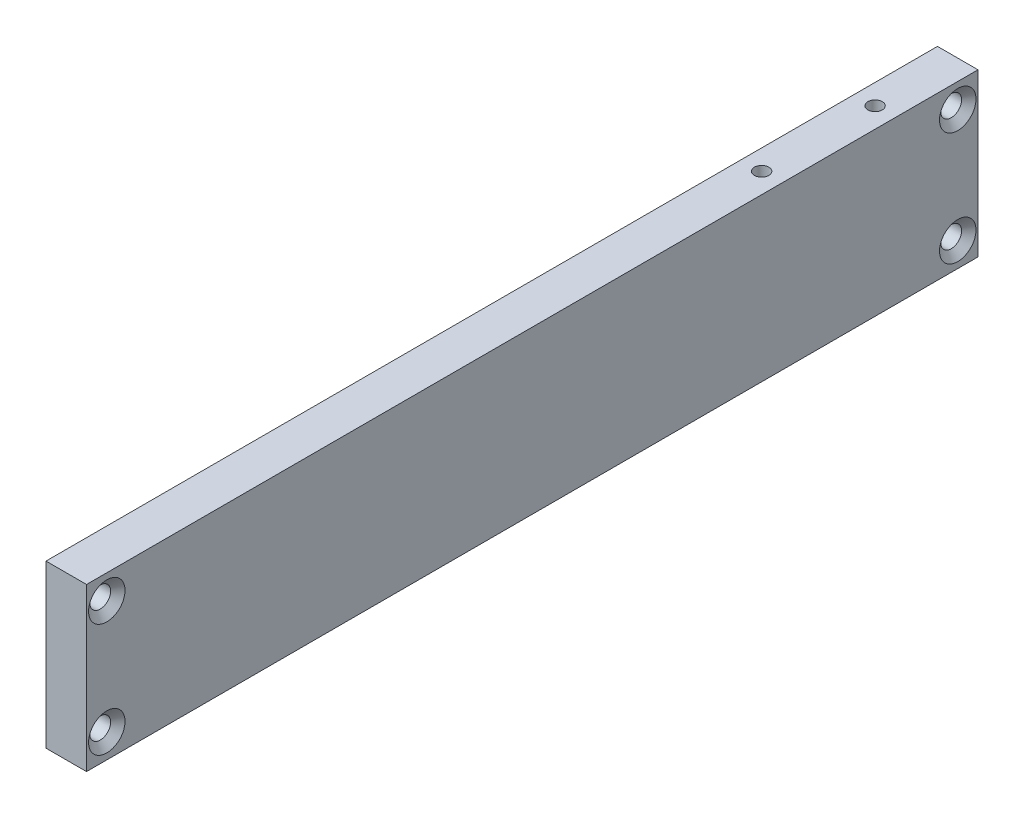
SolidWorks part; units mm, degrees
ref_plane "Front Plane" through (0, 0, 0) normal (0, 0, 1) x (1, 0, 0)
ref_plane "Top Plane" through (0, 0, 0) normal (0, 1, 0) x (1, 0, 0)
ref_plane "Right Plane" through (0, 0, 0) normal (1, 0, 0) x (0, 0, -1)
sketch "Sketch1" plane through (0, 0, 0) normal (1, 0, 0) x (0, 0, -1)
  line L1 (-69.85, 15.24) -> (69.85, 15.24)
  line L2 (-69.85, 15.24) -> (-69.85, -10.16)
  line L3 (-69.85, -10.16) -> (69.85, -10.16)
  line L4 (69.85, 15.24) -> (69.85, -10.16)
  dimension "D1" = 25.4
  dimension "D2" = 139.7
  dimension "D3" = 10.16
  dimension "D4" = 69.85
extrude "Extrude1" add sketch "Sketch1" along normal blind 6.35
sketch "Sketch2" plane through (6.35, 0, 0) normal (1, 0, 0) x (0, 0, -1)
  line L0 (-69.85, 15.24) -> (-69.85, -10.16) construction
  line L1 (69.85, -10.16) -> (69.85, 15.24) construction
  point P0 (-66.675, 11.43)
  point P1 (-66.675, -6.35)
  point P2 (66.675, 11.43)
  point P3 (66.675, -6.35)
  dimension "D1" = 17.78
  dimension "D2" = 3.175
  dimension "D3" = 3.175
  dimension "D4" = 6.35
  dimension "D5" = 6.35
hole_wizard "CSK for #4 Flat Head Machine Screw (100)1" positions "3DSketch1" profile "Sketch3" countersink size "#4" standard "Ansi Inch"
sketch3d "3DSketch1"
  point P0 (6.35, 11.43, 66.675)
  point P3 (6.35, -6.35, 66.675)
  point P6 (6.35, 11.43, -66.675)
  point P9 (6.35, -6.35, -66.675)
sketch "Sketch3" plane through (6.35, 11.43, 66.675) normal (0, 1, 0) x (0, 0, -1)
  line L0 (0, 0) -> (0, 6.35)
  line L1 (0, 6.35) -> (1.6319, 6.35)
  line L2 (1.6319, 6.35) -> (1.6319, 1.0284)
  line L3 (1.6319, 1.0284) -> (2.8575, 0)
  line L5 (2.8575, 0) -> (0, 0)
  line L6 (-1.6319, 1.0284) -> (-2.8575, 0) construction
  line L11 (0, -6.35) -> (0, 107.95) construction
  dimension "Thru Hole Dia." = 3.2639
  dimension "Thru Hole Depth" = 6.35
  dimension "Near C'Sink Dia." = 5.715
  dimension "Near C'Sink Angle" = 100
hole_wizard "#4-40 Tapped Hole1" positions "3DSketch2" profile "Sketch4" tap size "#4-40" standard "Ansi Inch"
sketch3d "3DSketch2"
  line L1 (6.35, 15.24, -69.85) -> (6.35, 15.24, 69.85) construction
  line L2 (6.35, 15.24, -69.85) -> (0, 15.24, -69.85) construction
  point P0 (3.175, 15.24, -39.116)
  point P2 (3.175, 15.24, -56.896)
  point P13 (-19.4149, 102.494, 0)
  dimension "D1" = 12.954
  dimension "D2" = 17.78
  dimension "D3" = 3.175
sketch "Sketch4" plane through (3.175, 15.24, -39.116) normal (1, 0, 0) x (0, 0, 1)
  line L0 (0, 0) -> (0, 12.1092)
  line L1 (0, 12.1092) -> (1.1303, 11.43)
  line L2 (1.1303, 11.43) -> (1.1303, 0)
  line L5 (1.1303, 0) -> (0, 0)
  line L10 (0, 12.1092) -> (-1.1303, 11.43) construction
  line L11 (0, -6.35) -> (0, 107.95) construction
  dimension "Tap Drill Dia." = 2.2606
  dimension "Tap Drill Depth" = 11.43
  dimension "Drill Angle" = 118
hole_wizard "#4-40 Tapped Hole2" positions "3DSketch3" profile "Sketch5" tap size "#4-40" standard "Ansi Inch"
sketch3d "3DSketch3"
  line L0 (6.35, -10.16, -69.85) -> (0, -10.16, -69.85) construction
  line L1 (6.35, -10.16, 69.85) -> (6.35, -10.16, -69.85) construction
  point P0 (3.175, -10.16, -39.116)
  point P2 (3.175, -10.16, -56.896)
  dimension "D1" = 12.954
  dimension "D2" = 17.78
  dimension "D3" = 3.175
sketch "Sketch5" plane through (3.175, -10.16, -39.116) normal (1, 0, 0) x (0, 0, -1)
  line L0 (0, 0) -> (0, 12.1092)
  line L1 (0, 12.1092) -> (1.1303, 11.43)
  line L2 (1.1303, 11.43) -> (1.1303, 0)
  line L5 (1.1303, 0) -> (0, 0)
  line L10 (0, 12.1092) -> (-1.1303, 11.43) construction
  line L11 (0, -6.35) -> (0, 107.95) construction
  dimension "Tap Drill Dia." = 2.2606
  dimension "Tap Drill Depth" = 11.43
  dimension "Drill Angle" = 118
